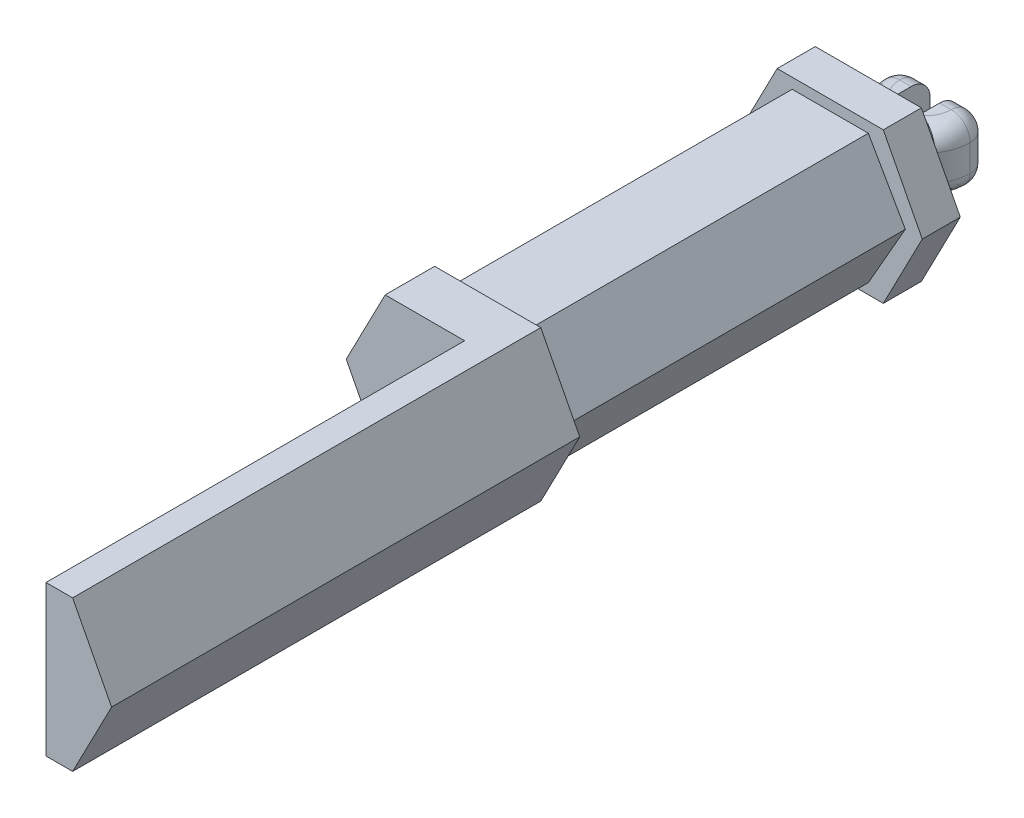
SolidWorks part; units mm, degrees
ref_plane "Plan1" through (0, 0, 0) normal (0, 0, 1) x (1, 0, 0)
ref_plane "Plan2" through (0, 0, 0) normal (0, 1, 0) x (1, 0, 0)
ref_plane "Plan3" through (0, 0, 0) normal (1, 0, 0) x (0, 0, -1)
sketch "Esquisse1" plane through (0, 0, 0) normal (0, 0, 1) x (1, 0, 0)
  line L0 (-2.7882, 3.95) -> (2.7882, 3.95)
  line L1 (2.7882, 3.95) -> (4.835, 0)
  line L2 (4.835, 0) -> (2.7882, -3.95)
  line L3 (2.7882, -3.95) -> (-2.7882, -3.95)
  line L4 (-2.7882, -3.95) -> (-4.835, 0)
  line L5 (-4.835, 0) -> (-2.7882, 3.95)
  line L6 (-2.7882, 3.95) -> (2.7882, -3.95) construction
  line L7 (2.7882, 3.95) -> (-2.7882, -3.95) construction
  line L8 (-4.835, 0) -> (4.835, 0) construction
  dimension "D1" = 7.9
extrude "Base-Extrusion" add sketch "Esquisse1" along normal blind 2
sketch "Esquisse2" plane through (0, 0, 2) normal (0, 0, 1) x (1, 0, 0)
  line L0 (-2, 3.4) -> (2, 3.4)
  line L1 (2, 3.4) -> (3.9446, 0)
  line L2 (3.9446, 0) -> (2, -3.4)
  line L3 (2, -3.4) -> (-2, -3.4)
  line L4 (-2, -3.4) -> (-3.9446, 0)
  line L5 (-3.9446, 0) -> (-2, 3.4)
  line L6 (-2, 3.4) -> (2, -3.4) construction
  line L7 (-2, -3.4) -> (2, 3.4) construction
  line L8 (-3.9446, 0) -> (3.9446, 0) construction
  dimension "D1" = 6.8
extrude "Boss.-Extru.1" add sketch "Esquisse2" along normal blind 18
sketch "Esquisse3" plane through (0, 0, 20) normal (0, 0, 1) x (1, 0, 0)
  line L0 (-2.7882, 3.95) -> (2.7882, 3.95)
  line L1 (2.7882, 3.95) -> (4.835, 0)
  line L2 (4.835, 0) -> (2.7882, -3.95)
  line L3 (2.7882, -3.95) -> (4.835, 0) construction
  line L4 (2.7882, -3.95) -> (-2.7882, -3.95)
  line L5 (-2.7882, -3.95) -> (2.7882, -3.95) construction
  line L6 (-2.7882, -3.95) -> (-4.835, 0)
  line L7 (-4.835, 0) -> (-2.7882, 3.95)
extrude "Boss.-Extru.2" add sketch "Esquisse3" along normal blind 24.6
sketch "Esquisse4" plane through (0, 0, 44.6) normal (0, 0, 1) x (1, 0, 0)
  line L1 (-5.612, 4) -> (1.3882, 4)
  line L2 (-5.612, 4) -> (-5.612, -4)
  line L3 (-5.612, -4) -> (1.3882, -4)
  line L4 (1.3882, 4) -> (1.3882, -4)
  dimension "D1" = 1.4
extrude "Enlèv. mat.-Extru.1" cut sketch "Esquisse4" against normal blind 22
sketch "Esquisse5" plane through (0, 0, 0) normal (0, 1, 0) x (1, 0, 0)
  line L0 (0.75, 0) -> (0.75, 4)
  line L1 (2.7882, 0) -> (-2.7882, 0) construction
  line L2 (0.75, 4) -> (1.35, 4)
  line L5 (1.9, 1.6171) -> (1.9, 0)
  line L6 (1.9, 0) -> (0.75, 0)
  line L7 (-0.75, 0) -> (-0.75, 4)
  line L8 (-0.75, 4) -> (-1.35, 4)
  line L11 (-2, 1.7661) -> (-2, 0)
  line L12 (-2, 0) -> (-0.75, 0)
  arc A0 (-2.35, 3) -> (-2, 1.7661) centre (0, 3) ccw
  arc A1 (1.9, 1.6171) -> (2.35, 3) centre (0, 3) ccw
  arc A2 (-2.35, 3) -> (-1.35, 4) centre (-1.35, 3) cw
  arc A3 (2.35, 3) -> (1.35, 4) centre (1.35, 3) ccw
  dimension "D4" = 1
  dimension "D1" = 0.75
  dimension "D2" = 1.5
  dimension "D3" = 3.9
  dimension "D6" = 4
  dimension "D9" = 3
extrude "Boss.-Extru.3" add sketch "Esquisse5" along normal mid plane 3.3
fillet "Congé variable2" radius 1
fillet "Congé variable3" radius 1
fillet "Congé variable7" radius 1
fillet "Congé variable9" radius 0.9
